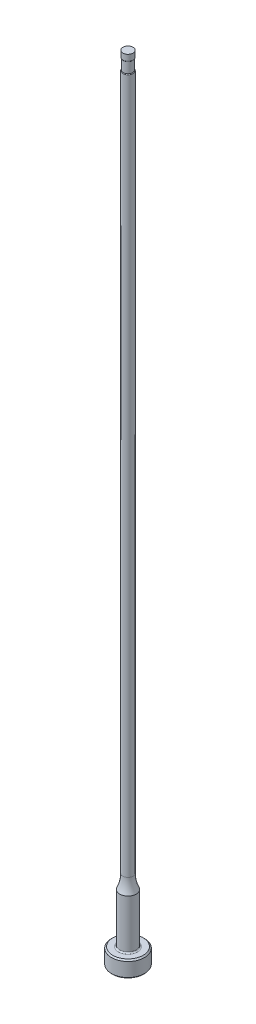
SolidWorks part; units mm, degrees
ref_plane "Front Plane" through (0, 0, 0) normal (0, 0, 1) x (1, 0, 0)
ref_plane "Top Plane" through (0, 0, 0) normal (0, 1, 0) x (1, 0, 0)
ref_plane "Right Plane" through (0, 0, 0) normal (1, 0, 0) x (0, 0, -1)
other "Configuration Table"
sketch "Sketch1" plane through (0, 0, 0) normal (0, 0, 1) x (1, 0, 0)
  line L0 (0, 259.9588) -> (0, -15.1925) construction
  line L1 (0, 0) -> (-3.175, 0)
  line L2 (-3.175, 0) -> (-3.175, 3.175)
  line L3 (-3.175, 3.175) -> (-1.5875, 3.175)
  line L4 (-0.9919, 15.3851) -> (-0.9919, 152.4)
  line L5 (-0.9919, 152.4) -> (0, 152.4)
  line L6 (0, 152.4) -> (0, 0)
  line L7 (-1.5875, 3.175) -> (-1.5875, 12.7)
  arc A1 (-1.5875, 12.7) -> (-0.9919, 15.3851) centre (-7.3419, 15.3851) ccw
  dimension "D1" = 6.35
  dimension "L" = 152.4
  dimension "D2" = 3.175
  dimension "H" = 6.35
  dimension "T" = 3.175
  dimension "D" = 1.9837
  dimension "S" = 12.7
revolve "Revolve1" add sketch "Sketch1" angle 360 about L0
chamfer "Chamfer1" distance 0.254 angle 45 2 edges at (0, 3.175, 3.175) (0, 0, 3.175)
fillet "Fillet1" radius 0.254 1 edges at (0, 3.175, 1.5875)
sketch "Sketch2" plane through (0, 0, 0) normal (0, 0, 1) x (1, 0, 0)
  line L0 (-0.9919, 152.4) -> (-0.9919, 15.3851) construction
  line L1 (-0.9919, 151.13) -> (-0.8903, 151.13)
  line L2 (-0.9919, 151.13) -> (-0.9919, 149.098)
  line L3 (-0.9919, 149.098) -> (-0.8903, 149.098)
  line L4 (-0.8903, 151.13) -> (-0.8903, 149.098)
  line L5 (0.9919, 152.4) -> (-0.9919, 152.4) construction
  line L6 (0, 153.4483) -> (0, 147.3282) construction
  dimension "D1" = 2.032
  dimension "N" = 1.27
  dimension "FD" = 0.1016
  dimension "D3" = 1.7805
revolve "Vent Relief" cut sketch "Sketch2" angle 360 about L6
sketch "Sketch3" plane through (0, 0, 0) normal (0, 0, 1) x (1, 0, 0)
  line L0 (-0.8903, 150.114) -> (-0.8903, 112.014)
  line L1 (-0.8903, 151.13) -> (-0.8903, 149.098) construction
  line L2 (-0.9919, 149.098) -> (-0.9919, 15.3851) construction
  line L3 (-0.9919, 111.2172) -> (-0.9919, 150.114)
  line L4 (-0.9919, 150.114) -> (-0.8903, 150.114)
  arc A0 (-0.8903, 112.014) -> (-0.9919, 111.2172) centre (-4.0653, 112.014) cw
  dimension "D1" = 3.175
  dimension "D2" = 38.1
extrude "D-Slot" cut sketch "Sketch3" against normal through all both and the other way through all
sketch "Sketch5" plane through (0, 0, 0) normal (0, 0, 1) x (1, 0, 0)
  line L0 (-0.9919, 151.13) -> (0.9919, 151.13) construction
  line L1 (-0.9919, 152.4) -> (-0.9792, 152.4)
  line L2 (-0.9919, 152.4) -> (-0.9919, 151.13)
  line L3 (-0.9919, 151.13) -> (-0.9792, 151.13)
  line L4 (-0.9792, 152.4) -> (-0.9792, 151.13)
  line L5 (0, 152.6877) -> (0, 150.5771) construction
  dimension "VP" = 0.0127
revolve "Vent Diameter" cut sketch "Sketch5" angle 360 about L5
fillet "Fillet2" radius 0.127 2 edges at (0.9919, 149.098, 0) (0, 151.13, 0.9792)
sketch "Pocket Sketch" plane through (0, 0, 0) normal (0, 0, 1) x (1, 0, 0)
  line L0 (-3.5719, 0) -> (-3.5719, 3.2004)
  line L1 (-3.5719, 3.2004) -> (-1.9523, 3.2004)
  line L2 (-1.1903, 3.9624) -> (-1.1903, 22.225)
  line L3 (-1.1903, 22.225) -> (0, 22.225)
  line L4 (0, 22.225) -> (0, 0)
  line L5 (0, 0) -> (-3.5719, 0)
  line L6 (0, 12.6104) -> (0, -2.4989) construction
  line L7 (-3.175, 2.921) -> (-3.175, 0.254) construction
  line L8 (2.921, 3.175) -> (-2.921, 3.175) construction
  line L9 (-0.9919, 111.2172) -> (-0.9919, 15.3851) construction
  line L10 (-1.9523, 3.2004) -> (-1.1903, 3.9624)
  point P3 (-1.1903, 3.2004)
  dimension "D1" = 7.1437
  dimension "D2" = 0.3969
  dimension "D3" = 0.0254
  dimension "D4" = 0.1984
  dimension "D5" = 2.3806
  dimension "D6" = 22.225
